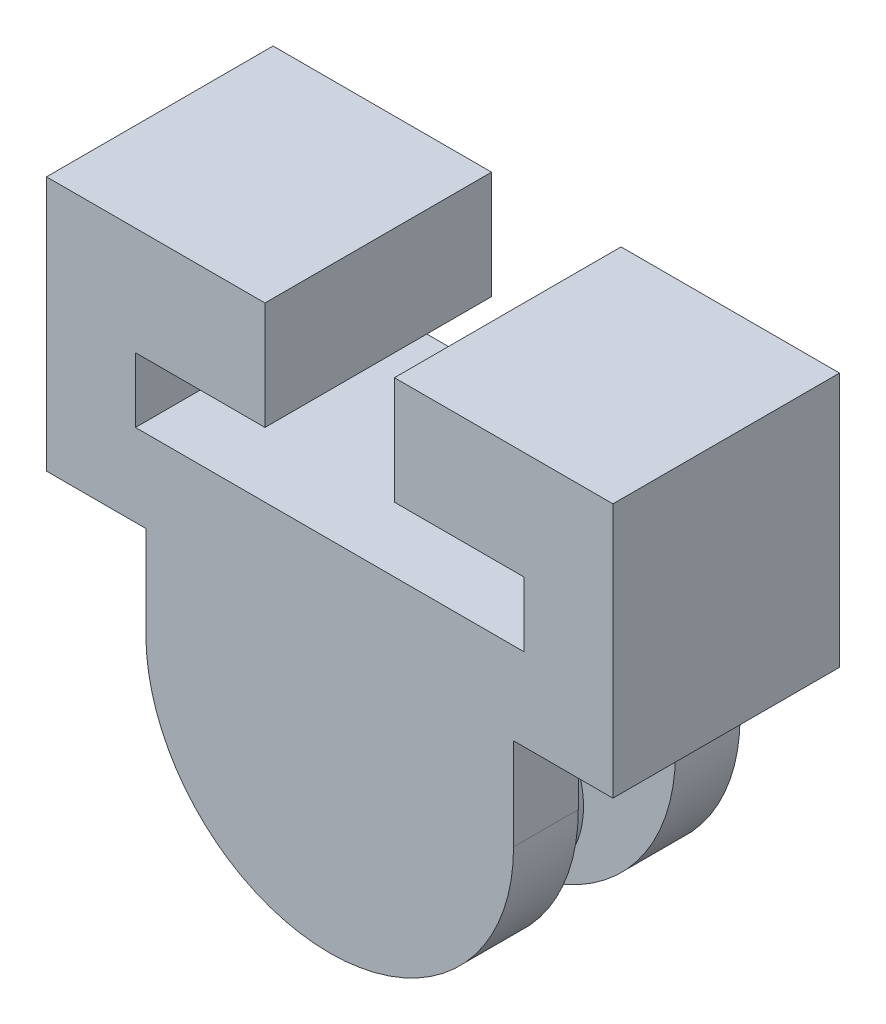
SolidWorks part; units mm, degrees
ref_plane "Front Plane" through (0, 0, 0) normal (0, 0, 1) x (1, 0, 0)
ref_plane "Top Plane" through (0, 0, 0) normal (0, 1, 0) x (1, 0, 0)
ref_plane "Right Plane" through (0, 0, 0) normal (1, 0, 0) x (0, 0, -1)
sketch "Sketch1" plane through (0, 0, 0) normal (0, 0, 1) x (1, 0, 0)
  line L2 (-36.0664, 36.0664) -> (-36.0664, 54.0996)
  line L3 (-36.0664, 54.0996) -> (36.0664, 54.0996)
  line L4 (36.0664, 36.0664) -> (36.0664, 54.0996)
  arc A1 (36.0664, 36.0664) -> (-36.0664, 36.0664) centre (0, 36.0664) cw
  point P0 (0, 54.0996)
extrude "Section B" add sketch "Sketch1" along normal blind 12.7
sketch "Sketch3" plane through (0, 0, 12.7) normal (0, 0, 1) x (1, 0, 0)
  line L1 (0, -24.4475) -> (0, 24.4475) construction
  circle A1 centre (0, 18.0332) radius 18.0332
extrude "Section A" add sketch "Sketch3" along normal blind 19.05
sketch "Sketch4" plane through (0, 0, 0) normal (0, 0, 1) x (1, 0, 0)
  line L0 (0, 14.478) -> (0, 42.8606) construction
  line L2 (-55.5625, 54.0996) -> (55.5625, 54.0996)
  line L3 (-55.5625, 54.0996) -> (-55.5625, 70.2516)
  line L4 (-55.5625, 70.2516) -> (55.5625, 70.2516)
  line L5 (55.5625, 54.0996) -> (55.5625, 70.2516)
  line L6 (36.0664, 54.0996) -> (-36.0664, 54.0996) construction
extrude "Section C" add sketch "Sketch4" along normal up to surface (31.75 mm away)
sketch "Sketch5" plane through (0, 0, 0) normal (0, 0, 1) x (1, 0, 0)
  line L0 (0, -24.4475) -> (0, 24.4475) construction
  line L1 (55.5625, 70.2516) -> (38.1, 70.2516)
  line L2 (55.5625, 70.2516) -> (55.5625, 82.9516)
  line L3 (55.5625, 82.9516) -> (38.1, 82.9516)
  line L4 (38.1, 70.2516) -> (38.1, 82.9516)
  line L5 (-55.5625, 82.9516) -> (-38.1, 82.9516)
  line L6 (-38.1, 70.2516) -> (-38.1, 82.9516)
  line L7 (-55.5625, 70.2516) -> (-38.1, 70.2516)
  line L8 (-55.5625, 70.2516) -> (-55.5625, 82.9516)
extrude "Section D" add sketch "Sketch5" along normal up to surface (31.75 mm away)
sketch "Sketch6" plane through (0, 0, 0) normal (0, 0, 1) x (1, 0, 0)
  line L0 (0, -24.4475) -> (0, 24.4475) construction
  line L1 (55.5625, 82.9516) -> (12.7, 82.9516)
  line L2 (55.5625, 82.9516) -> (55.5625, 104.1059)
  line L3 (55.5625, 104.1059) -> (12.7, 104.1059)
  line L4 (12.7, 82.9516) -> (12.7, 104.1059)
  line L5 (-55.5625, 104.1059) -> (-12.7, 104.1059)
  line L6 (-12.7, 82.9516) -> (-12.7, 104.1059)
  line L7 (-55.5625, 82.9516) -> (-12.7, 82.9516)
  line L8 (-55.5625, 82.9516) -> (-55.5625, 104.1059)
extrude "Section E" add sketch "Sketch6" along normal up to surface (31.75 mm away)
sketch "Sketch8" plane through (0, 0, 31.75) normal (0, 0, 1) x (1, 0, 0)
  line L0 (-12.7, 104.1059) -> (-55.5625, 104.1059)
  line L1 (-55.5625, 104.1059) -> (-55.5625, 54.0996)
  line L2 (-55.5625, 54.0996) -> (-36.0664, 54.0996)
  line L3 (55.5625, 54.0996) -> (55.5625, 104.1059)
  line L4 (55.5625, 104.1059) -> (12.7, 104.1059)
  line L5 (12.7, 104.1059) -> (12.7, 82.9516)
  line L6 (12.7, 82.9516) -> (38.1, 82.9516)
  line L7 (38.1, 82.9516) -> (38.1, 70.2516)
  line L8 (38.1, 70.2516) -> (-38.1, 70.2516)
  line L9 (-38.1, 70.2516) -> (-38.1, 82.9516)
  line L10 (-38.1, 82.9516) -> (-12.7, 82.9516)
  line L11 (-12.7, 82.9516) -> (-12.7, 104.1059)
  line L12 (-36.0664, 36.0664) -> (-36.0664, 54.0996)
  line L13 (36.0664, 36.0664) -> (36.0664, 54.0996)
  line L14 (36.0664, 54.0996) -> (55.5625, 54.0996)
  arc A1 (-36.0664, 36.0664) -> (36.0664, 36.0664) centre (0, 36.0664) ccw
extrude "Final Design Iteration" add sketch "Sketch8" along normal blind 12.7
equation "\"F\"= 250"
equation "\"E\"= 600000"
equation "\"Ts\"= 20000"
equation "\"SF\"= 4"
equation "\"delta\"= 0.005in"
equation "\"Al\"= 0.75in"
equation "\"Ad\"= ( ( 2 * \"F\" * ( ( \"Al\" ) ^ 3 ) * \"SF\" * 64 ) / ( 8 * \"E\" * \"delta\" * pi ) ) ^ ( 1 / 4 ) + .5"
equation "\"Bl\"= ( 2 * \"F\" * \"Bh\" * \"SF\" ) / ( \"Bd\" * \"E\" * \"delta\" )"
equation "\"Bh\"= \"Ad\" + ( \"Ad\" / 2 )"
equation "\"Bd\"= 0.5"
equation "\"Dl\"= \"Al\""
equation "\"Dh\"= 0.5in"
equation "\"Dw\"= ( \"F\" * ( ( \"Dl\" ) ^ 3 ) * 12 * \"SF\" ) / ( 8 * \"delta\" * \"E\" * ( \"Dh\" ) ^ 3 ) - 1"
equation "\"Cl\"= \"Al\""
equation "\"Cw\"= 3 + ( 2 * \"Dw\" )"
equation "\"Ch\"= ( ( 2 * \"F\" * ( ( \"Cl\" ) ^ 3 ) * \"SF\" * 12 ) / ( 3 * \"E\" * \"delta\" * \"Cw\" ) ) ^ ( 1 / 3 )"
equation "\"El\"= \"Al\""
equation "\"Ew_calc\"= \"Dw\""
equation "\"Ew\"= \"Ew_calc\" + 1"
equation "\"Eh\"= ( ( \"F\" * ( \"Ew_calc\" ^ 3 ) * 12 * \"SF\" ) / ( 3 * \"E\" * \"delta\" * \"El\" ) ) ^ ( 1 / 3 )"
equation "\"D1@Section B\"=\"Bd\""
equation "\"D1@Sketch3\"=\"Ad\""
equation "\"D1@Section A\"=\"Al\""
equation "\"D1@Sketch4\"=\"Cw\""
equation "\"D2@Sketch4\"=\"Ch\""
equation "\"D1@Section C\"=\"Cl\""
equation "\"D1@Sketch5\"=\"Dh\""
equation "\"D2@Sketch5\"=\"Dw\""
equation "\"D1@Section D\"=\"Dl\""
equation "\"D1@Sketch6\"=\"Eh\""
equation "\"D2@Sketch6\"=\"Ew\""
equation "\"D1@Section E\"=\"El\""
equation "\"D2@Sketch1\"=\"Bh\""
equation "\"D4@Sketch1\"=\"Bl\""
equation "\"D3@Sketch1\"=\"Bh\"-\"Ad\""
equation "\"D1@Final Design Iteration\"=\"Bd\""
